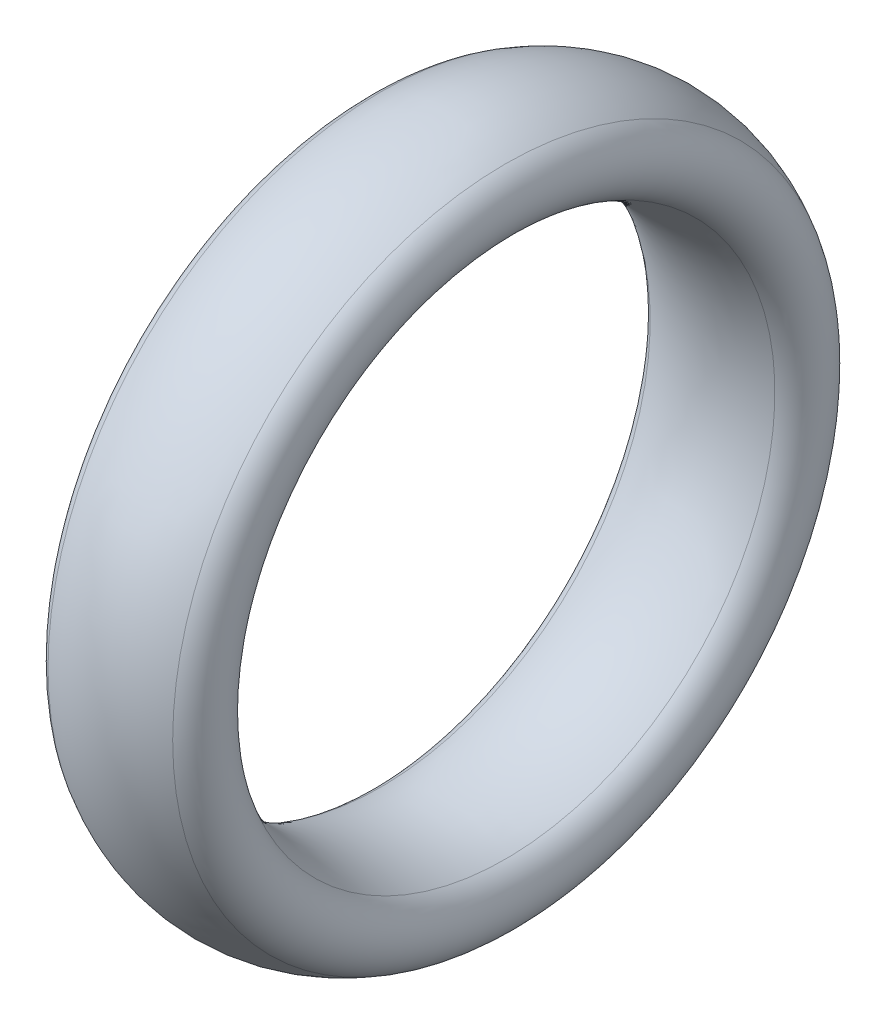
SolidWorks part; units mm, degrees
ref_plane "Plan de face" through (0, 0, 0) normal (0, 0, 1) x (1, 0, 0)
ref_plane "Plan de dessus" through (0, 0, 0) normal (0, 1, 0) x (1, 0, 0)
ref_plane "Plan de droite" through (0, 0, 0) normal (1, 0, 0) x (0, 0, -1)
sketch "Esquisse1" plane through (0, 0, 0) normal (0, 0, 1) x (1, 0, 0)
  line L0 (0, 0) -> (42.1165, 0) construction
  line L1 (15.366, -7.4665) -> (26.0267, -7.4665) construction
  line L2 (21.2429, -1.1915) -> (15.366, -1.1915) construction
  arc A0 (19.6971, 0.7819) -> (19.6971, -0.7819) centre (20.1429, 0) ccw
  arc A1 (22.7886, 0.7819) -> (19.6971, 0.7819) centre (21.2429, -1.9294) ccw
  arc A2 (22.7886, -0.7819) -> (22.7886, 0.7819) centre (22.3429, 0) ccw
  arc A3 (22.7886, -0.7819) -> (19.6971, -0.7819) centre (21.2429, 1.9294) cw
  dimension "D1" = 1.8
  dimension "D2" = 1.8
  dimension "D5" = 3.121
  dimension "D3" = 2.2
  dimension "D4" = 6.275
revolve "Révolution1" add sketch "Esquisse1" angle 360 about L1
